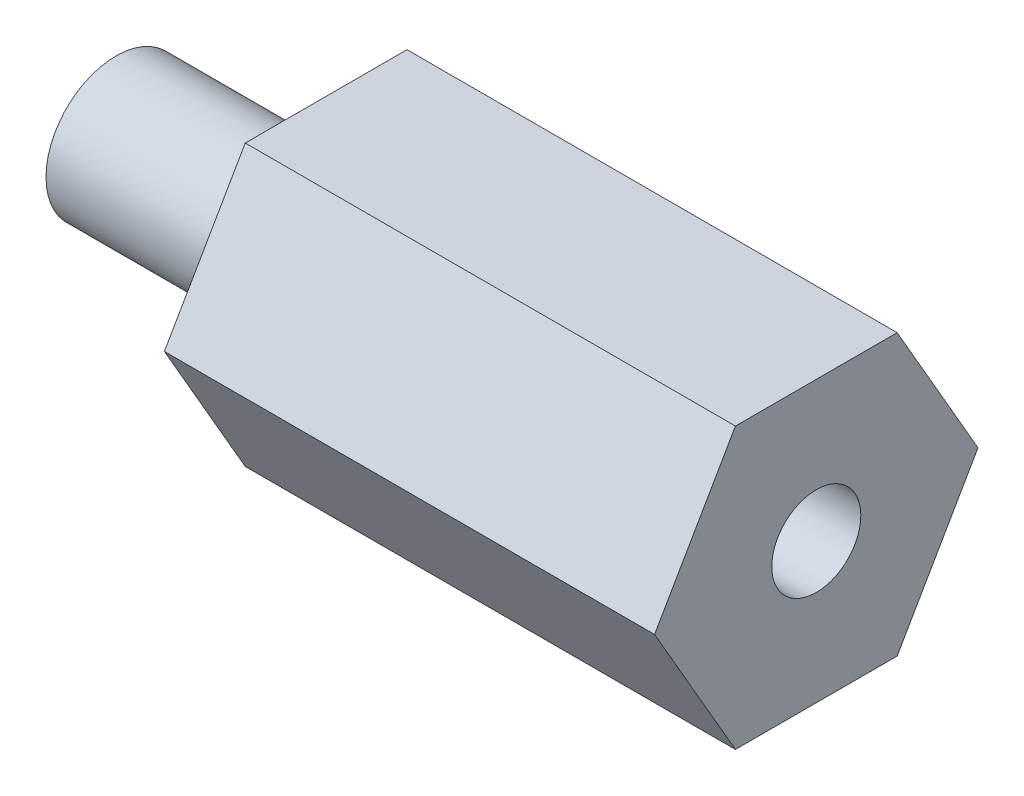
SolidWorks part; units mm, degrees
ref_plane "Front Plane" through (0, 0, 0) normal (0, 0, 1) x (1, 0, 0)
ref_plane "Top Plane" through (0, 0, 0) normal (0, 1, 0) x (1, 0, 0)
ref_plane "Right Plane" through (0, 0, 0) normal (1, 0, 0) x (0, 0, -1)
sketch "Sketch1" plane through (0, 0, 0) normal (1, 0, 0) x (0, 0, -1)
  line L1 (7.3323, 0) -> (3.6662, 6.35)
  line L2 (3.6662, 6.35) -> (-3.6662, 6.35)
  line L3 (-3.6662, 6.35) -> (-7.3323, 0)
  line L4 (-7.3323, 0) -> (-3.6662, -6.35)
  line L5 (-3.6662, -6.35) -> (3.6662, -6.35)
  line L6 (3.6662, -6.35) -> (7.3323, 0)
  circle A0 centre (0, 0) radius 6.35 construction
  dimension "D1" = 12.7
extrude "Boss-Extrude1" add sketch "Sketch1" along normal blind 31.75
hole_wizard "#10-32 Tapped Hole1" positions "3DSketch1" profile "Sketch2" tap size "#10-32" standard "ANSI Inch"
sketch3d "3DSketch1"
  line L0 (31.75, 6.35, 3.6662) -> (31.75, -6.35, -3.6662) construction
  point P0 (31.75, 0, 0)
sketch "Sketch2" plane through (31.75, 0, 0) normal (0, 1, 0) x (0, 0, -1)
  line L0 (0, 0) -> (0, 13.9133)
  line L1 (0, 13.9133) -> (2.0193, 12.7)
  line L2 (2.0193, 12.7) -> (2.0193, 0)
  line L5 (2.0193, 0) -> (0, 0)
  line L10 (0, 13.9133) -> (-2.0193, 12.7) construction
  line L11 (0, -6.35) -> (0, 107.95) construction
  dimension "Tap Drill Dia." = 4.0386
  dimension "Tap Drill Depth" = 12.7
  dimension "Drill Angle" = 118
sketch "Sketch3" plane through (0, 0, 0) normal (-1, 0, 0) x (0, 0, 1)
  circle A0 centre (0, 0) radius 7.3323
  circle A1 centre (0, 0) radius 3.175
  dimension "D1" = 6.35
extrude "Cut-Extrude1" cut sketch "Sketch3" against normal blind 9.525
